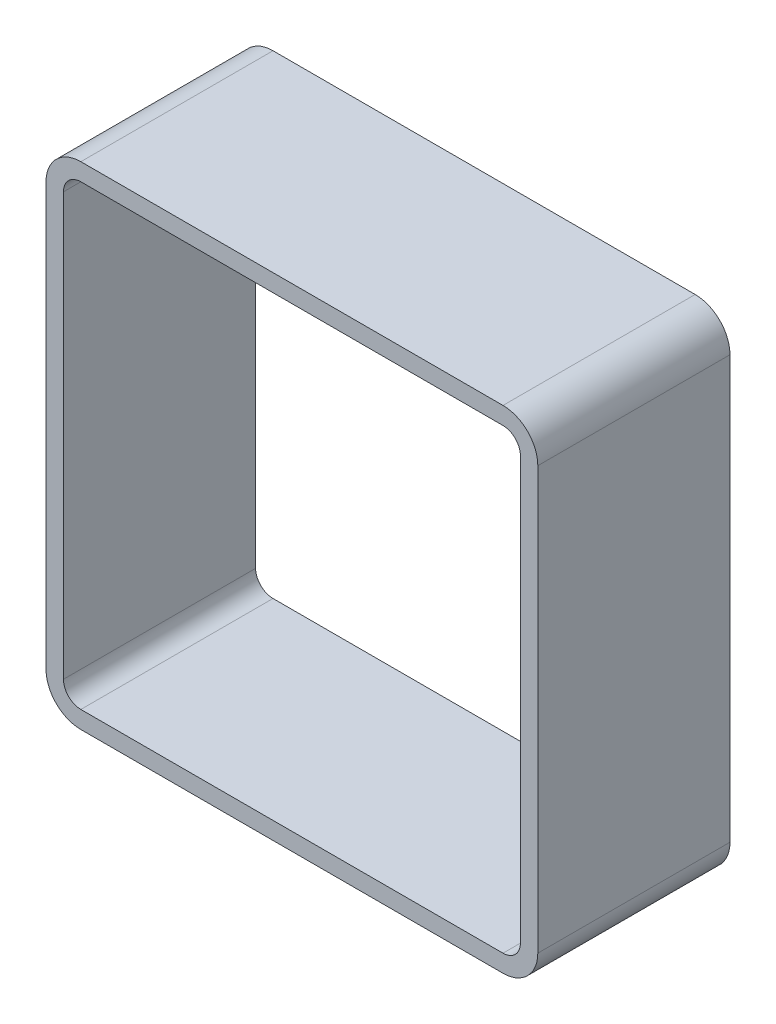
SolidWorks part; units mm, degrees
ref_plane "Front Plane" through (0, 0, 0) normal (0, 0, 1) x (1, 0, 0)
ref_plane "Top Plane" through (0, 0, 0) normal (0, 1, 0) x (1, 0, 0)
ref_plane "Right Plane" through (0, 0, 0) normal (1, 0, 0) x (0, 0, -1)
sketch "Sketch1" plane through (0, 0, 0) normal (0, 0, 1) x (1, 0, 0)
  line L0 (-27.9, 30.2) -> (27.9, 30.2)
  line L1 (-27.9, -32.5) -> (27.9, -32.5)
  line L2 (-32.5, -27.9) -> (-32.5, 27.9)
  line L3 (-27.9, 32.5) -> (27.9, 32.5)
  line L4 (32.5, -27.9) -> (32.5, 27.9)
  line L5 (-32.5, -32.5) -> (32.5, 32.5) construction
  line L6 (-32.5, 32.5) -> (32.5, -32.5) construction
  line L7 (30.2, -27.9) -> (30.2, 27.9)
  line L8 (-27.9, -30.2) -> (27.9, -30.2)
  line L9 (-30.2, -27.9) -> (-30.2, 27.9)
  arc A0 (-32.5, 27.9) -> (-27.9, 32.5) centre (-27.9, 27.9) cw
  arc A1 (27.9, 32.5) -> (32.5, 27.9) centre (27.9, 27.9) cw
  arc A2 (-27.9, -32.5) -> (-32.5, -27.9) centre (-27.9, -27.9) cw
  arc A3 (27.9, -32.5) -> (32.5, -27.9) centre (27.9, -27.9) ccw
  arc A4 (-30.2, 27.9) -> (-27.9, 30.2) centre (-27.9, 27.9) cw
  arc A5 (27.9, 30.2) -> (30.2, 27.9) centre (27.9, 27.9) cw
  arc A6 (27.9, -30.2) -> (30.2, -27.9) centre (27.9, -27.9) ccw
  arc A7 (-27.9, -30.2) -> (-30.2, -27.9) centre (-27.9, -27.9) cw
  point P0 (0, 0)
  dimension "D2" = 4.6
  dimension "Thickness" = 2.3
  dimension "Width" = 65
extrude "BaseSection" add sketch "Sketch1" along normal mid plane 25.4
equation "\"D2@Sketch1\" = \"Thickness@Sketch1\" * (  (IIf(\"Thickness@Sketch1\">3, 1.5, 1))  + 1 ) "
